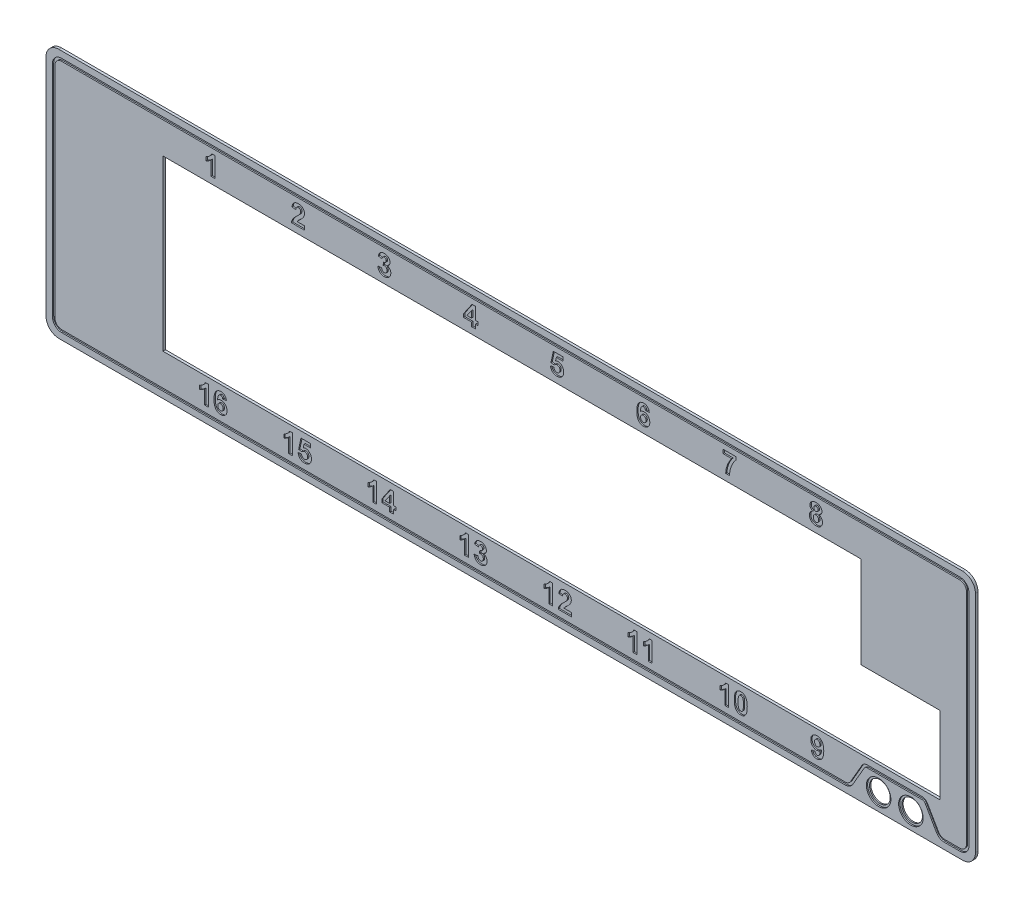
SolidWorks part; units mm, degrees
ref_plane "Front" through (0, 0, 0) normal (0, 0, 1) x (1, 0, 0)
ref_plane "Top" through (0, 0, 0) normal (0, 1, 0) x (1, 0, 0)
ref_plane "Right" through (0, 0, 0) normal (1, 0, 0) x (0, 0, -1)
sketch "Sketch1" plane through (0, 0, 0) normal (0, 0, 1) x (1, 0, 0)
  line L1 (-94.7683, -5.0822) -> (49.2317, -5.0822)
  line L2 (-94.7683, -5.0822) -> (-94.7683, -43.8822)
  line L3 (-94.7683, -43.8822) -> (49.2317, -43.8822)
  line L4 (49.2317, -5.0822) -> (49.2317, -43.8822)
  dimension "D1" = 144
  dimension "D2" = 38.8
extrude "Boss-Extrude1" add sketch "Sketch1" along normal blind 0.4
sketch "Sketch2" plane through (0, 0, 0) normal (0, 0, 1) x (1, 0, 0)
  line L0 (-76.4683, -37.3322) -> (-76.4683, -11.5322)
  line L1 (-76.4683, -11.5322) -> (31.3317, -11.5322)
  line L2 (31.3317, -11.5322) -> (31.3317, -25.7322)
  line L3 (31.3317, -25.7322) -> (43.5317, -25.7322)
  line L4 (43.5317, -25.7322) -> (43.5317, -37.3322)
  line L5 (43.5317, -37.3322) -> (-76.4683, -37.3322)
extrude "Cut-Extrude1" cut sketch "Sketch2" along normal blind 1
ref_plane "Plane1" through (0, 0, 0.4) normal (0, 0, 1) x (1, 0, 0)
sketch "Sketch3" plane through (0, 0, 0.4) normal (0, 0, 1) x (1, 0, 0)
  line L0 (-70.2683, -10.3322) -> (25.7317, -10.3322) construction
  line L1 (-71.2683, -41.5322) -> (28.7317, -41.5322) construction
  line L2 (-76.4683, -37.3322) -> (-76.4683, -11.5322) construction
  line L3 (-76.4683, -11.5322) -> (31.3317, -11.5322) construction
  line L4 (43.5317, -37.3322) -> (-76.4683, -37.3322) construction
  text T0 "12345678" font "Arial" height in points 12
  text T1 "16       15       14        13       12       11        10        9" font "Arial" height in points 12
  dimension "D1" = 5.2
  dimension "D2" = 100
  dimension "D3" = 6.2
  dimension "D4" = 96
  dimension "D5" = 1.2
  dimension "D6" = 4.2
sketch "Sketch4" plane through (0, 0, 0) normal (0, 0, 1) x (1, 0, 0)
  circle A0 centre (34.2317, -41.2822) radius 1.6
  circle A1 centre (39.2317, -41.2822) radius 1.6
  dimension "D1" = 3.2
  dimension "D2" = 3.2
extrude "Cut-Extrude2" cut sketch "Sketch4" along normal blind 1
extrude "Cut-Extrude3" cut sketch "Sketch3" against normal blind 0.2
sketch "Sketch5" plane through (0, 0, 0) normal (0, 0, 1) x (1, 0, 0)
  line L0 (-76.4683, -11.5322) -> (31.3317, -11.5322) construction
  line L1 (-76.4683, -11.5322) -> (31.3317, -11.5322)
  line L2 (-76.4683, -11.5322) -> (-76.4683, -37.3322)
  line L3 (-76.4683, -37.3322) -> (43.5317, -37.3322)
  line L4 (43.5317, -37.3322) -> (43.5317, -25.7322)
  line L5 (43.5317, -25.7322) -> (31.3317, -25.7322)
  line L6 (31.3317, -25.7322) -> (31.3317, -11.5322)
extrude "Cut-Extrude-Thin1" cut sketch "Sketch5" along normal blind 1 thin
sketch "Sketch6" plane through (0, 0, 0.4) normal (0, 0, 1) x (1, 0, 0)
  line L1 (-93.3683, -7.4822) -> (-93.3683, -41.4822)
  line L2 (-92.3683, -42.4822) -> (29.0356, -42.4822)
  line L3 (29.9016, -41.9822) -> (31.6336, -38.9822)
  line L4 (32.4997, -38.4822) -> (40.945, -38.4822)
  line L5 (41.811, -38.9822) -> (43.543, -41.9822)
  line L6 (44.4091, -42.4822) -> (46.8317, -42.4822)
  line L7 (47.8317, -41.4822) -> (47.8317, -7.4822)
  line L8 (46.8317, -6.4822) -> (-92.3683, -6.4822)
  line L9 (49.2317, -5.0822) -> (-94.7683, -5.0822) construction
  line L10 (49.2317, -43.8822) -> (49.2317, -5.0822) construction
  line L11 (-94.7683, -43.8822) -> (49.2317, -43.8822) construction
  line L12 (-94.7683, -5.0822) -> (-94.7683, -43.8822) construction
  arc A0 (44.4091, -42.4822) -> (43.543, -41.9822) centre (44.4091, -41.4822) cw
  arc A1 (41.811, -38.9822) -> (40.945, -38.4822) centre (40.945, -39.4822) ccw
  arc A2 (32.4997, -38.4822) -> (31.6336, -38.9822) centre (32.4997, -39.4822) ccw
  arc A3 (29.9016, -41.9822) -> (29.0356, -42.4822) centre (29.0356, -41.4822) cw
  arc A4 (47.8317, -41.4822) -> (46.8317, -42.4822) centre (46.8317, -41.4822) cw
  arc A5 (46.8317, -6.4822) -> (47.8317, -7.4822) centre (46.8317, -7.4822) cw
  arc A6 (-93.3683, -41.4822) -> (-92.3683, -42.4822) centre (-92.3683, -41.4822) ccw
  arc A7 (-92.3683, -6.4822) -> (-93.3683, -7.4822) centre (-92.3683, -7.4822) ccw
  point P18 (43.8317, -42.4822)
  point P21 (41.5223, -38.4822)
  point P24 (31.9223, -38.4822)
  point P27 (29.6129, -42.4822)
  point P30 (47.8317, -42.4822)
  dimension "D9" = 1
  dimension "D1" = 1.4
  dimension "D2" = 1.4
  dimension "D3" = 1.4
  dimension "D4" = 4
  dimension "D5" = 9.6
  dimension "D6" = 1.4
  dimension "D7" = 4
  dimension "D8" = 1.4
  dimension "D10" = 120
  dimension "D11" = 120
extrude "Cut-Extrude-Thin3" cut sketch "Sketch6" against normal blind 0.2 thin
fillet "Fillet1" radius 2 4 edges at (49.2317, -43.8822, 0.2) (49.2317, -5.0822, 0.2) (-94.7683, -43.8822, 0.2) (-94.7683, -5.0822, 0.2)
sketch "Sketch7" plane through (0, 0, 0.4) normal (0, 0, 1) x (1, 0, 0)
  circle A0 centre (34.2317, -41.2822) radius 1.6
  circle A1 centre (39.2317, -41.2822) radius 1.6
  dimension "D1" = 3.2
  dimension "D2" = 3.2
extrude "Cut-Extrude-Thin4" cut sketch "Sketch7" against normal blind 0.2 thin
